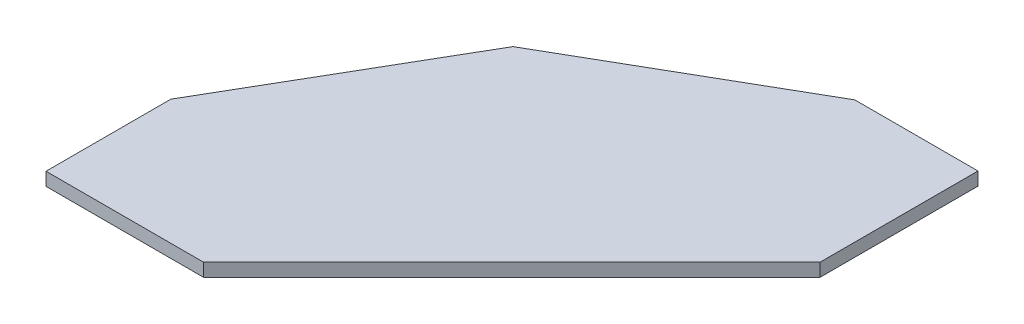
SolidWorks part; units mm, degrees
ref_plane "Plan de face" through (0, 0, 0) normal (0, 0, 1) x (1, 0, 0)
ref_plane "Plan de dessus" through (0, 0, 0) normal (0, 1, 0) x (1, 0, 0)
ref_plane "Plan de droite" through (0, 0, 0) normal (1, 0, 0) x (0, 0, -1)
sketch "Esquisse1" plane through (0, 0, 0) normal (0, 1, 0) x (1, 0, 0)
  line L0 (-845, 0) -> (-540, 0)
  line L1 (-540, 0) -> (0, 540)
  line L2 (0, 845) -> (0, 540)
  line L3 (-215.8736, 816.96) -> (0, 816.96)
  line L4 (-816.2073, 218.7021) -> (-595.432, 599.5713)
  line L5 (-597.5052, 597.5052) -> (-215.8736, 816.96)
  line L6 (-816.2073, 218.7021) -> (-816.2073, 0)
  arc A0 (-215.8736, 816.96) -> (-595.432, 599.5713) centre (0, 0) ccw
  arc A1 (-540, 0) -> (0, 540) centre (0, 0) cw
  arc A2 (0, 845) -> (-215.8736, 816.96) centre (0, 0) ccw
  arc A3 (-845, 0) -> (-816.2073, 218.7021) centre (0, 0) cw
  arc A4 (-816.2073, 218.7021) -> (-597.5052, 597.5052) centre (0, 0) cw
  arc A5 (-816.2073, 218.7021) -> (-816.2073, -218.7021) centre (0, 0) ccw
  arc A6 (-215.8736, 816.96) -> (221.528, 815.4449) centre (0, 0) cw
  dimension "D1" = 1195.0105
  dimension "D2" = 463.1573
extrude "Boss.-Extru.1" add sketch "Esquisse1" along normal blind 23
